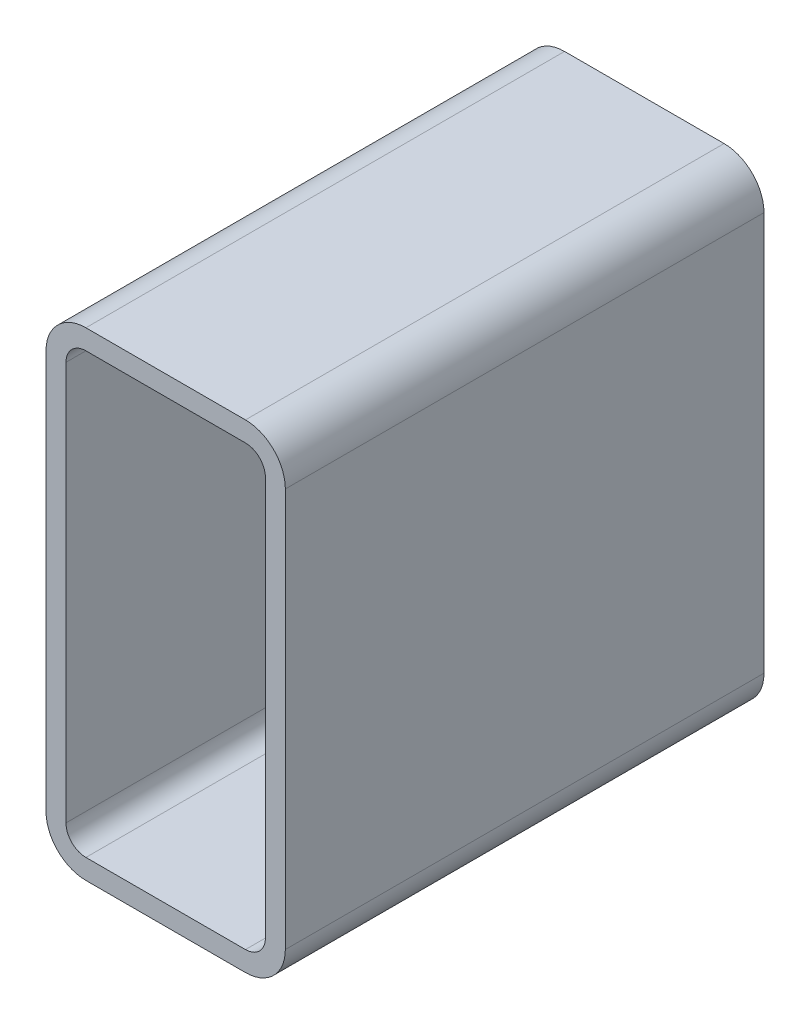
SolidWorks part; units mm, degrees
ref_plane "Front Plane" through (0, 0, 0) normal (0, 0, 1) x (1, 0, 0)
ref_plane "Top Plane" through (0, 0, 0) normal (0, 1, 0) x (1, 0, 0)
ref_plane "Right Plane" through (0, 0, 0) normal (1, 0, 0) x (0, 0, -1)
sketch "Sketch1" plane through (0, 0, 0) normal (0, 0, 1) x (1, 0, 0)
sketch_block_instance "HSS12x6x0.500-1"
sketch_block "HSS12x6x0.500"
extrude "Boss-Extrude1" add sketch "Sketch1" along normal blind 304.8
